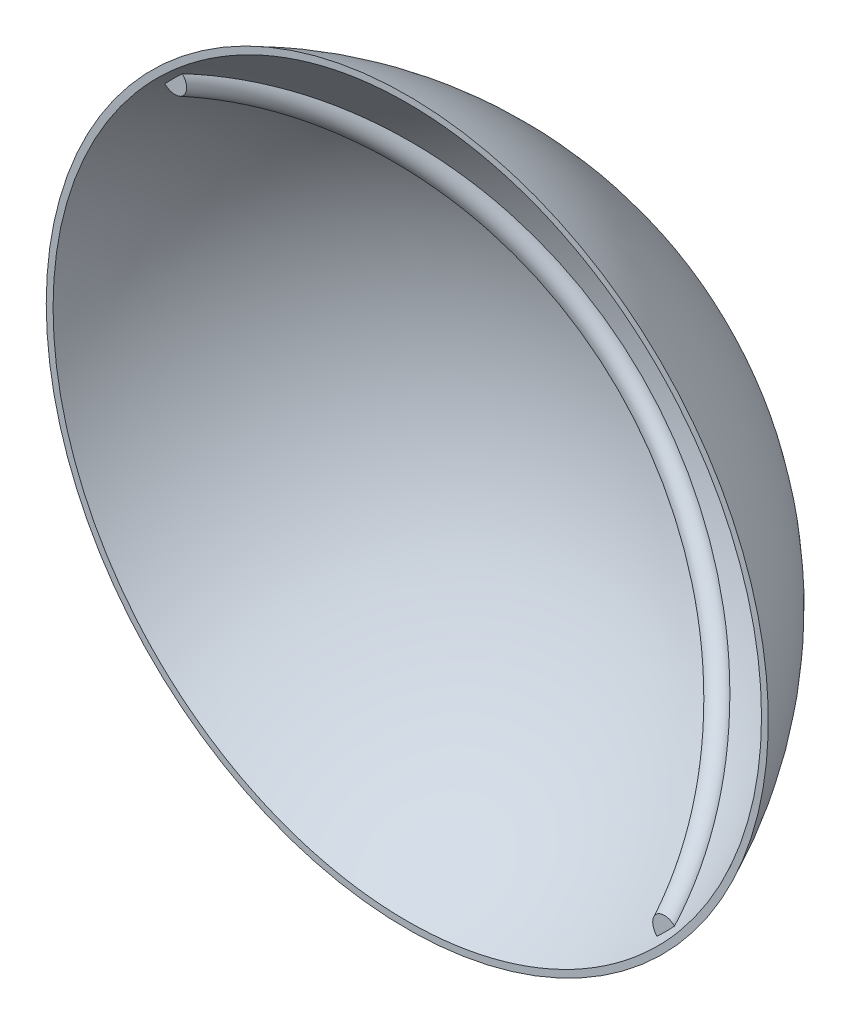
SolidWorks part; units mm, degrees
ref_plane "Front" through (0, 0, 0) normal (0, 0, 1) x (1, 0, 0)
ref_plane "Top" through (0, 0, 0) normal (0, 1, 0) x (1, 0, 0)
ref_plane "Right" through (0, 0, 0) normal (1, 0, 0) x (0, 0, -1)
sketch "Sketch1" plane through (0, 0, 0) normal (0, 0, 1) x (1, 0, 0)
  line L0 (0, 101.6) -> (0, 100.0125) construction
  line L1 (0, 101.6) -> (0, 100.0125)
  line L2 (0, -100.0125) -> (0, -101.6)
  line L3 (0, -100.0125) -> (0, -101.6) construction
  arc A0 (0, -100.0125) -> (0, 100.0125) centre (0, 0) ccw
  arc A1 (0, -101.6) -> (0, 101.6) centre (0, 0) ccw
  dimension "D1" = 1.5875
  dimension "D2" = 203.2
revolve "Revolve1" add sketch "Sketch1" angle 360 about L1
sketch "Sketch4" plane through (0, 0, 0) normal (0, 0, 1) x (1, 0, 0)
  line L1 (-47.7447, 0) -> (0, 0) construction
  line L2 (0, 0) -> (19.765, 19.765) construction
  line L3 (0, 0) -> (-70.7195, 70.7195) construction
  circle A0 centre (0, 0) radius 100.0125
  arc A1 (-68.4391, 72.9287) -> (-72.9287, 68.4391) centre (0, 0) ccw
  arc A2 (-72.9287, 68.4391) -> (-68.4391, 72.9287) centre (-70.7195, 70.7195) ccw
  dimension "D1" = 6.35
  dimension "D2" = 45
revolve "Revolve2" add sketch "Sketch4" angle 360 about L2
sketch "Sketch2" plane through (0, 0, 0) normal (1, 0, 0) x (0, 0, -1)
  line L2 (42.0334, 93.9648) -> (42.0334, -93.9648)
  line L3 (42.0334, 92.4973) -> (42.0334, -92.4973) construction
extrude "Cut-Extrude1" cut sketch "Sketch2" against normal through all and the other way through all flip side to cut
sketch "Sketch3" plane through (0, 0, 0) normal (1, 0, 0) x (0, 0, -1)
  circle A1 centre (0, 0) radius 23.1521
  circle A2 centre (0, 0) radius 23.1521
  dimension "D1" = 0
extrude "Cut-Extrude2" cut sketch "Sketch3" along normal through all
sketch "Sketch5" plane through (0, 0, 0) normal (0, 1, 0) x (1, 0, 0)
  line L0 (-90.7507, 42.0334) -> (-81.755, 42.0334)
  line L1 (-92.4973, 42.0334) -> (92.4973, 42.0334) construction
  line L2 (-81.755, 42.0334) -> (-81.755, 45.2084)
  line L3 (-81.755, 45.2084) -> (-89.2116, 45.2084)
  line L4 (0, 0) -> (0, 15.2512) construction
  arc A0 (-4.4896, 99.9117) -> (-90.7507, 42.0334) centre (0, 0) ccw
  arc A1 (-89.2116, 45.2084) -> (-90.7507, 42.0334) centre (0, 0) ccw
  dimension "D1" = 3.175
revolve "Cut-Revolve1" cut sketch "Sketch5" angle 360 about L4
